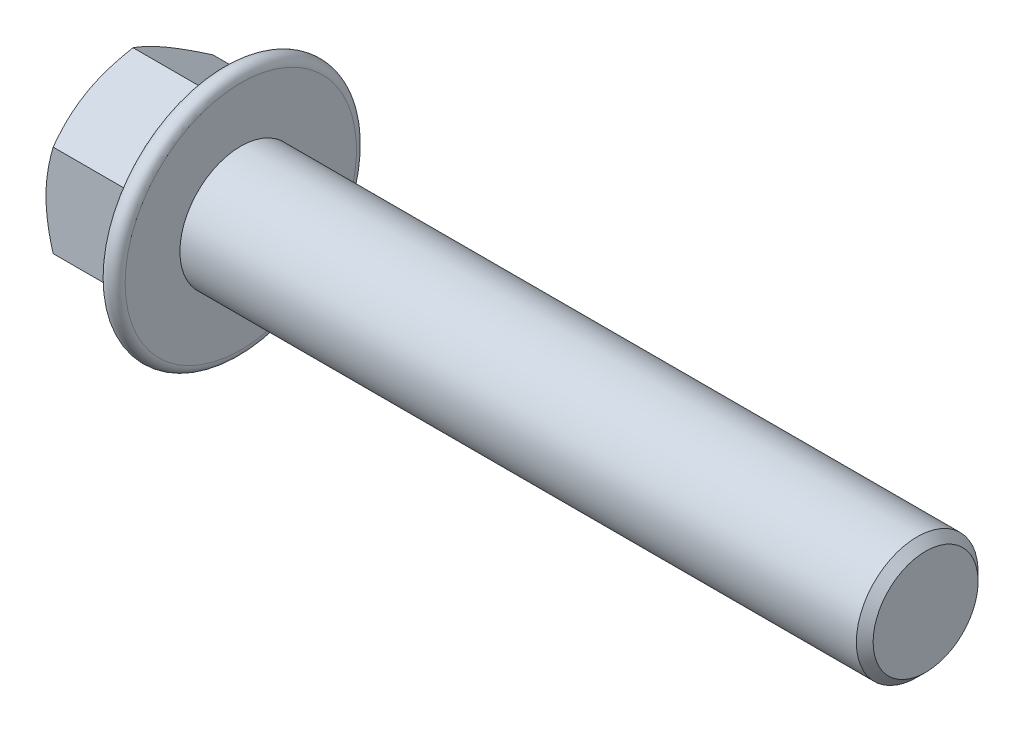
SolidWorks part; units mm, degrees
ref_plane "Plane1" through (0, 0, 0) normal (0, 0, 1) x (1, 0, 0)
ref_plane "Plane2" through (0, 0, 0) normal (0, 1, 0) x (1, 0, 0)
ref_plane "Plane3" through (0, 0, 0) normal (1, 0, 0) x (0, 0, -1)
sketch "Sketch1" plane through (0, 0, 0) normal (1, 0, 0) x (0, 0, -1)
  line L0 (10.5, 6.0622) -> (10.5, -6.0622)
  line L1 (-10.5, 6.0622) -> (-10.5, -6.0622)
  line L2 (10.5, -6.0622) -> (0, -12.1244)
  line L3 (0, -12.1244) -> (-10.5, -6.0622)
  line L4 (10.5, 6.0622) -> (0, 12.1244)
  line L5 (0, 12.1244) -> (-10.5, 6.0622)
  dimension "Width_flats" = 21
  dimension "D2" = 120
  dimension "D3" = 10.5
  dimension "D4" = 10.5
  dimension "D5" = 10.5
extrude "BaseHead" add sketch "Sketch1" along normal blind 15.1
sketch "BodySke" plane through (0, 0, 0) normal (0, 0, 1) x (1, 0, 0)
  line L0 (0, 6.0622) -> (0, -6.0622) construction
  line L1 (0, 0) -> (105.1, 0)
  line L2 (0, 0) -> (0, 8)
  line L3 (0, 8) -> (103.9985, 8)
  line L4 (105.1, 0) -> (105.1, 6.8985)
  line L5 (15.1, 12.1244) -> (15.1, 6.0622) construction
  line L6 (105.1, 6.8985) -> (103.9985, 8)
  line L7 (0, 0) -> (96.52, 0) construction
  line L8 (105.1, -6.8985) -> (103.9985, -8) construction
  line L9 (0, -8) -> (103.9985, -8) construction
  line L10 (17.1, 15.24) -> (17.1, -1.27) construction
  line L11 (67.1, 15.24) -> (67.1, -1.27) construction
  line L12 (15.1, 6.0622) -> (15.1, -6.0622) construction
  dimension "Length" = 90
  dimension "Body_ch_ang" = 45
  dimension "Diameter" = 16
  dimension "Minor_dia" = 13.797
  dimension "Advance" = 2
  dimension "Thread_nom" = 38
revolve "BaseBody" add sketch "BodySke"
fillet "HeadFillet" [suppressed] radius 0.8
sketch "Sketch3" plane through (0, 0, 0) normal (0, 0, 1) x (1, 0, 0)
  line L0 (0, 10.5) -> (3.8246, 17.1244)
  line L1 (0, 12.1244) -> (0, 6.0622) construction
  line L2 (3.8246, 17.1244) -> (3.8246, 22.1244)
  line L3 (3.8246, 22.1244) -> (-10, 22.1244)
  line L4 (-10, 22.1244) -> (-10, 10.5)
  line L5 (-10, 10.5) -> (0, 10.5)
  line L6 (0, 0) -> (99.06, 0) construction
  line L7 (15.1, 12.1244) -> (0, 12.1244) construction
  dimension "D1" = 10.5
  dimension "D2" = 5
  dimension "D3" = 10
  dimension "D4" = 5
  dimension "Head_ch_ang" = 30
revolve "HeadChamfer" cut sketch "Sketch3" angle 360 about L6
sketch "Sketch4" plane through (0, 0, 0) normal (0, 0, 1) x (1, 0, 0)
  line L0 (7.0906, 0) -> (12.7724, 15.6104)
  line L1 (15.1, 12.1244) -> (15.1, 6.0622) construction
  line L2 (12.7, 34.3444) -> (12.7, 16.9779) construction
  line L3 (15.1, 0) -> (15.1, 15.2)
  line L4 (8.3021, 16.4) -> (20.1618, 16.4) construction
  line L5 (0, 0) -> (95.25, 0) construction
  line L6 (0, 0) -> (96.52, 0) construction
  line L7 (7.0906, 0) -> (15.1, 0)
  line L8 (8.3021, -16.4) -> (20.1618, -16.4) construction
  arc A0 (15.1, 15.2) -> (12.7724, 15.6104) centre (13.9, 15.2) ccw
  dimension "D1" = 20
  dimension "Flange_thickness" = 2.4
  dimension "Flange_dia" = 32.8
revolve "Flange" add sketch "Sketch4" angle 360 about L5
fillet "FlangeHexFillet" radius 1 6 edges
sketch "ThdSchSke" plane through (0, 0, 0) normal (0, 0, 1) x (1, 0, 0)
  line L0 (67.1, -6.8985) -> (66.3287, -8)
  line L1 (67.1, -6.8985) -> (67.8713, -8)
  line L2 (67.8713, -8) -> (67.8713, -10)
  line L3 (-3.175, 0) -> (5.1513, 0) construction
  line L5 (67.8713, -10) -> (66.3287, -10)
  line L6 (66.3287, -10) -> (66.3287, -8)
  dimension "Thread_minor" = 13.797
  dimension "Diameter" = 16
  dimension "Start" = 67.1
  dimension "SideAngle" = 55
  dimension "VeeAngle" = 70
  dimension "Overcut" = 20
revolve "ThreadSchematic" [suppressed] cut sketch "ThdSchSke" angle 360 about L3
pattern_linear "ThdSchPat" [suppressed]
equation "\"D3@Sketch1\" = \"Width_flats@Sketch1\" / 2"
equation "\"D4@Sketch1\" = \"D3@Sketch1\""
equation "\"D5@Sketch1\" = \"D4@Sketch1\""
equation "\"Thread_minor@ThreadCosmetic\" = \"Minor_dia@BodySke\""
equation "\"D1@Sketch3\" = \"Width_flats@Sketch1\" / 2"
equation "\"Thread_length@ThreadCosmetic\" = ((sgn( (\"Length@BodySke\" - \"Advance@BodySke\" ) - \"Thread_nom@BodySke\" )-1)*( (\"Length@BodySke\" - \"Advance@BodySke\" ) - \"Thread_nom@BodySke\" ))/-2+ \"Thread_nom@BodySke\""
equation "\"Thread_minor@ThdSchSke\" = \"Minor_dia@BodySke\""
equation "\"Diameter@ThdSchSke\" = \"Diameter@BodySke\""
equation "\"Overcut@ThdSchSke\" = \"Diameter@BodySke\" * 1.25"
equation "\"Start@ThdSchSke\" = \"Head_ht@BaseHead\" + \"Length@BodySke\" - \"Thread_length@ThreadCosmetic\"  '---Non-countersunk---"
equation "\"Num_threads@ThdSchPat\" = int( \"Thread_length@ThreadCosmetic\" / \"Advance@BodySke\" + 0.999 )  + 1"
equation "\"Advance@ThdSchPat\" = \"Thread_length@ThreadCosmetic\" /  (\"Num_threads@ThdSchPat\" - 1) 'relax it"
equation "\"Num_threads@ThdSchPat\" = \"Num_threads@ThdSchPat\" - sgn( \"Num_threads@ThdSchPat\" - 1) '---chamfered tips only---"
